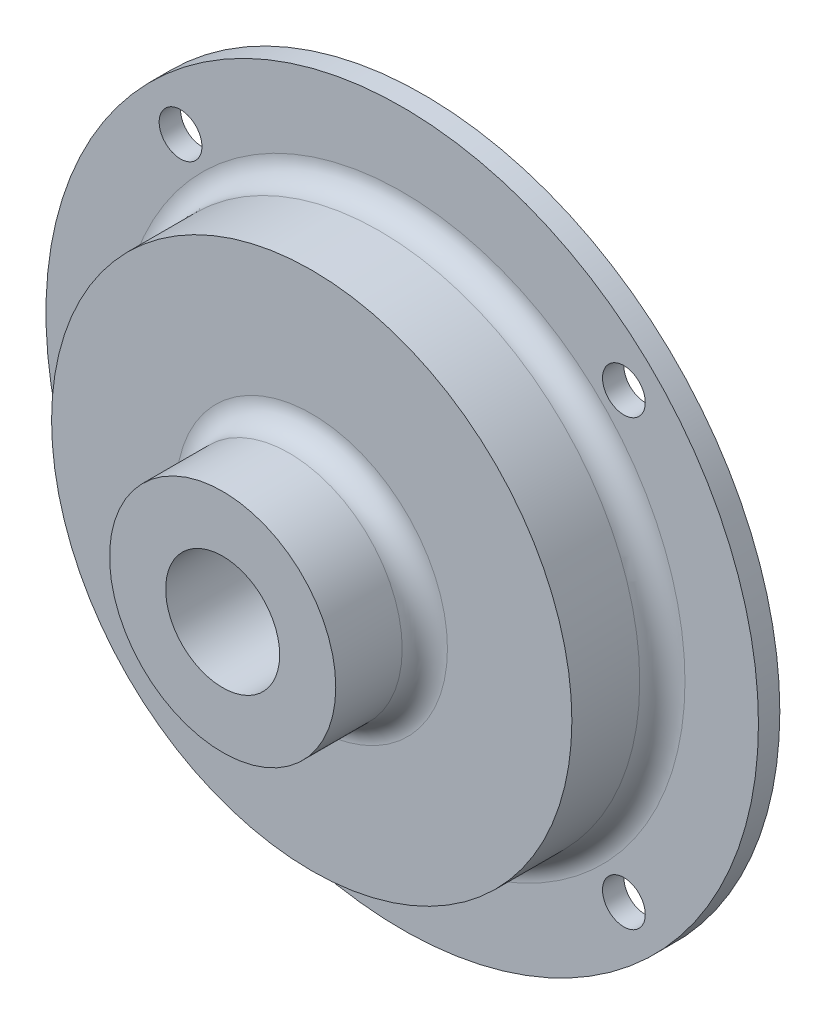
SolidWorks part; units mm, degrees
ref_plane "Front" through (0, 0, 0) normal (0, 0, 1) x (1, 0, 0)
ref_plane "Top" through (0, 0, 0) normal (0, 1, 0) x (1, 0, 0)
ref_plane "Right" through (0, 0, 0) normal (1, 0, 0) x (0, 0, -1)
sketch "Sketch1" plane through (0, 0, 0) normal (0, 0, 1) x (1, 0, 0)
  line L0 (0, 0) -> (50, 0) construction
  line L1 (0, 0) -> (35.3553, 35.3553) construction
  line L2 (0, 0) -> (-35.3553, 35.3553) construction
  circle A0 centre (0, 0) radius 50
  circle A1 centre (0, 0) radius 44 construction
  circle A2 centre (31.1127, 31.1127) radius 3
  circle A4 centre (-31.1127, -31.1127) radius 3
  circle A6 centre (31.1127, -31.1127) radius 3
  circle A7 centre (-31.1127, 31.1127) radius 3
  dimension "D1" = 100
  dimension "D3" = 6
  dimension "D4" = 88
  dimension "D2" = 45
extrude "Base-Extrude" add sketch "Sketch1" along normal blind 3
sketch "Sketch2" plane through (0, 0, 3) normal (0, 0, 1) x (1, 0, 0)
  circle A0 centre (0, 0) radius 36.5125
  dimension "D1" = 73.025
extrude "Boss-Extrude1" add sketch "Sketch2" along normal blind 12.7
sketch "Sketch3" plane through (0, 0, 15.7) normal (0, 0, 1) x (1, 0, 0)
  circle A0 centre (0, 0) radius 15.875
  dimension "D1" = 31.75
extrude "Boss-Extrude2" add sketch "Sketch3" along normal blind 12.5
fillet "Fillet1" radius 3.175 2 edges at (36.5125, 0, 3) (15.875, 0, 15.7)
sketch "Sketch4" plane through (0, 0, 28.2) normal (0, 0, 1) x (1, 0, 0)
  circle A0 centre (0, 0) radius 8
  dimension "D1" = 16
extrude "Cut-Extrude1" cut sketch "Sketch4" against normal through all
